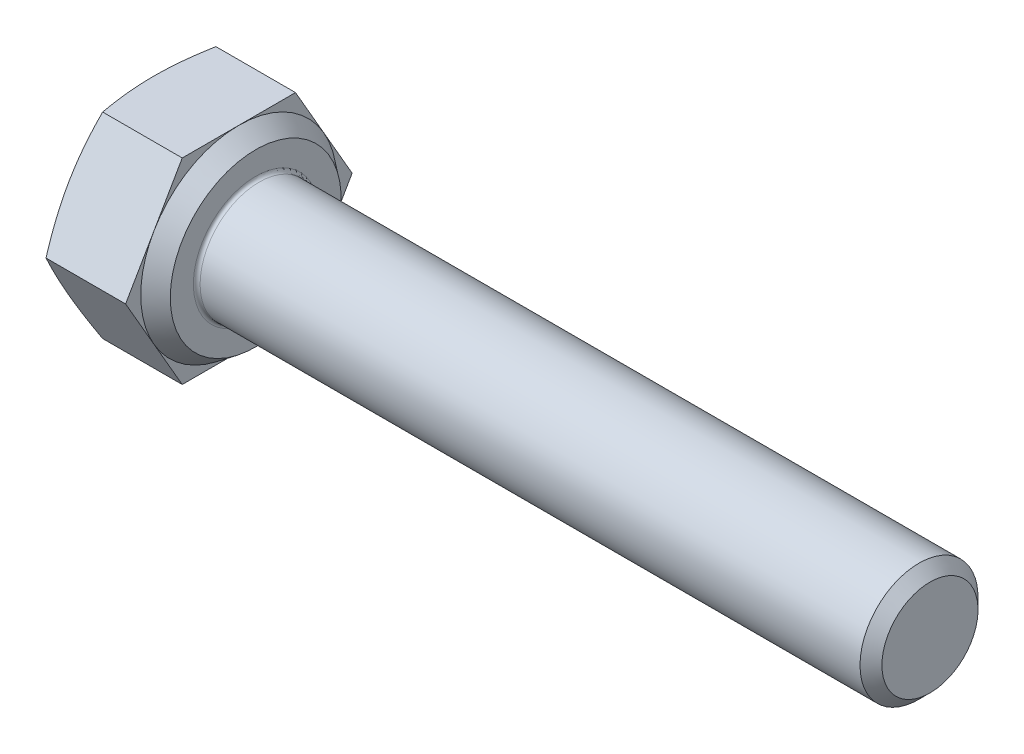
SolidWorks part; units mm, degrees
ref_plane "Front" through (0, 0, 0) normal (0, 0, 1) x (1, 0, 0)
ref_plane "Top" through (0, 0, 0) normal (0, 1, 0) x (1, 0, 0)
ref_plane "Right" through (0, 0, 0) normal (1, 0, 0) x (0, 0, -1)
sketch "Sketch-BaseHead" plane through (0, 0, 0) normal (1, 0, 0) x (0, 0, -1)
  line L1 (3.3602, 0) -> (1.6801, 2.91)
  line L2 (1.6801, 2.91) -> (-1.6801, 2.91)
  line L3 (-1.6801, 2.91) -> (-3.3602, 0)
  line L4 (-3.3602, 0) -> (-1.6801, -2.91)
  line L5 (-1.6801, -2.91) -> (1.6801, -2.91)
  line L6 (1.6801, -2.91) -> (3.3602, 0)
  circle A0 centre (0, 0) radius 2.91 construction
  dimension "s" = 5.82
extrude "BaseHead" add sketch "Sketch-BaseHead" along normal blind 2.525
sketch "Sketch4" plane through (-0.2646, 0, 5.9169) normal (0, 1, 0) x (0, 0, -1)
  line L0 (5.9169, 3.7369) -> (5.9169, -10.4477) construction
  line L2 (9.2771, -0.2646) -> (8.8269, -0.2646)
  line L4 (8.8269, -0.2646) -> (9.2771, -0.4285)
  line L6 (9.2771, -0.4285) -> (9.2771, -0.2646)
  dimension "D1" = 20
  dimension "D2" = 5.82
revolve "HeadChamfer" cut sketch "Sketch4" angle 360 about L0
sketch "Sketch1" plane through (0, 0, 0) normal (0, 0, 1) x (1, 0, 0)
  line L0 (2.525, 0) -> (3.025, 0)
  line L1 (3.025, 0) -> (3.025, -2.535)
  line L2 (3.025, -2.535) -> (2.525, -2.91)
  line L3 (2.525, -2.91) -> (2.525, 0) construction
  line L4 (0, 0) -> (7.5821, 0) construction
  line L5 (-4.0016, 0) -> (10.1831, 0) construction
  line L6 (2.525, -2.91) -> (0.1639, -2.91) construction
  line L7 (2.525, 0) -> (2.525, -2.91)
  dimension "D1" = 2.91
  dimension "c" = 0.5
  dimension "D2" = 2.535
revolve "Revolve1" add sketch "Sketch1" angle 360 about axis through (-4.0016, 0, 0) along (1, 0, 0)
ref_plane "Plane2" through (10.025, 0, 0) normal (1, 0, 0) x (0, 0, -1)
sketch "Sketch3" plane through (3.025, 0, 0) normal (1, 0, 0) x (0, 0, -1)
  circle A0 centre (0, 0) radius 1.75
  dimension "d" = 3.5
extrude "BaseBody" add sketch "Sketch3" along normal blind 20
fillet "HeadFillet" radius 0.1 1 edges at (3.025, 0, -1.75)
chamfer "Chamfer1" distance 0.325 angle 45 1 edges at (23.025, 0, -1.75)
equation "\"D1@Sketch1\" = \"s@Sketch-BaseHead\"/ 2"
equation "\"D2@Sketch4\" = \"s@Sketch-BaseHead\""
equation "\"D1@Chamfer1\" =  ( \"d@Sketch3\" - \"D2@ThreadCosmetic1\" ) / 2 "
equation "\"b@ThreadCosmetic1\" = \"l@BaseBody\" - \"lg@Plane2\""
